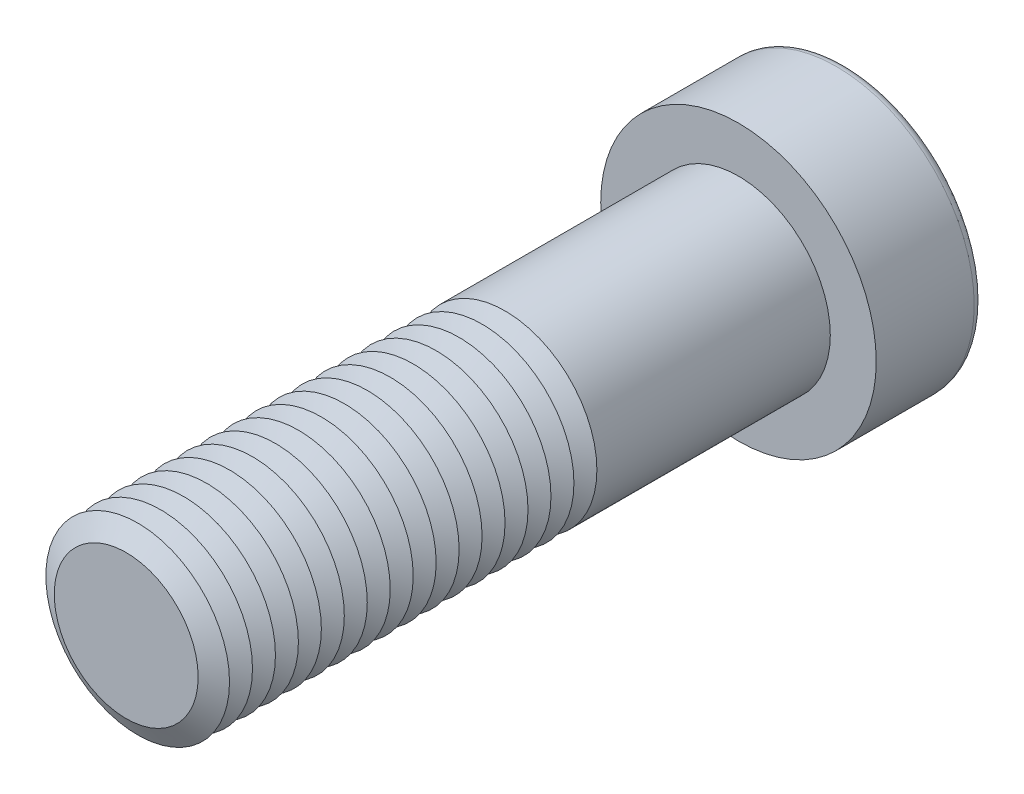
SolidWorks part; units mm, degrees
ref_plane "Front Plane" through (0, 0, 0) normal (0, 0, 1) x (1, 0, 0)
ref_plane "Top Plane" through (0, 0, 0) normal (0, 1, 0) x (1, 0, 0)
ref_plane "Right Plane" through (0, 0, 0) normal (1, 0, 0) x (0, 0, -1)
sketch "Sketch1" plane through (0, 0, 0) normal (0, 0, 1) x (1, 0, 0)
  circle A0 centre (0, 0) radius 12
  dimension "D1" = 24
extrude "Boss-Extrude1" add sketch "Sketch1" along normal blind 80
sketch "Sketch2" plane through (0, 0, 0) normal (0, 0, -1) x (-1, 0, 0)
  circle A0 centre (0, 0) radius 18
  dimension "D1" = 36
extrude "Boss-Extrude2" add sketch "Sketch2" along normal blind 14
sketch "Sketch3" plane through (0, 0, -14) normal (0, 0, -1) x (-1, 0, 0)
  line L1 (-5.4848, 9.5) -> (-10.9697, 0)
  line L2 (-10.9697, 0) -> (-5.4848, -9.5)
  line L3 (-5.4848, -9.5) -> (5.4848, -9.5)
  line L4 (5.4848, -9.5) -> (10.9697, 0)
  line L5 (10.9697, 0) -> (5.4848, 9.5)
  line L6 (5.4848, 9.5) -> (-5.4848, 9.5)
  circle A0 centre (0, 0) radius 9.5 construction
  dimension "D1" = 19
extrude "Cut-Extrude1" cut sketch "Sketch3" against normal blind 14.25
fillet "Fillet1" radius 1.2 1 edges at (-18, 0, -14)
sketch "Sketch4" plane through (0, 0, 0.25) normal (0, 0, -1) x (-1, 0, 0)
  line L0 (5.4848, -9.5) -> (10.9697, 0) construction
  circle A0 centre (0, 0) radius 9.5
extrude "Cut-Extrude2" cut sketch "Sketch4" against normal through all draft 60
sketch "Sketch5" plane through (0, 0, -14) normal (0, 0, -1) x (-1, 0, 0)
  circle A0 centre (0, 0) radius 10.9697
extrude "Cut-Extrude3" cut sketch "Sketch5" against normal through all draft 75
sketch "Sketch7" plane through (0, 0, 0) normal (1, 0, 0) x (0, 0, -1)
  line L25 (-80, 9.4019) -> (-78.5, 12)
  line L26 (-80, 12) -> (-80, -12) construction
  line L27 (-78.5, 12) -> (-81.5, 12)
  line L28 (-81.5, 12) -> (-80, 9.4019)
  line L29 (0, 12) -> (-80, 12) construction
  dimension "D1" = 3
revolve "Cut-Revolve1" cut sketch "Sketch7" angle 360 about axis through (0, 0, 80) along (0, 0, -1)
pattern_linear "LPattern1" count 17 spacing 3 along (0, 0, -1) of "Cut-Revolve1"
